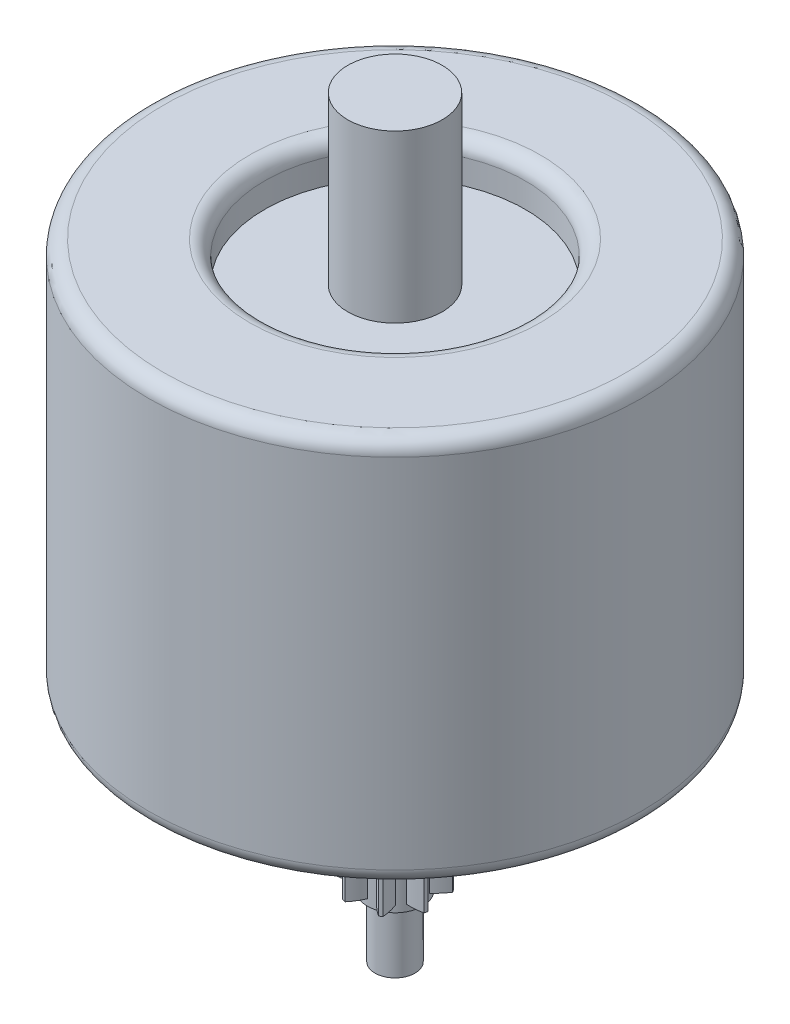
SolidWorks part; units mm, degrees
ref_plane "Front Plane" through (0, 0, 0) normal (0, 0, 1) x (1, 0, 0)
ref_plane "Top Plane" through (0, 0, 0) normal (0, 1, 0) x (1, 0, 0)
ref_plane "Right Plane" through (0, 0, 0) normal (1, 0, 0) x (0, 0, -1)
sketch "Sketch1" plane through (0, 0, 0) normal (0, 1, 0) x (1, 0, 0)
  circle A0 centre (0, 0) radius 16.45
  dimension "D1" = 32.9
extrude "Boss-Extrude1" add sketch "Sketch1" along normal blind 25.85
sketch "Sketch2" plane through (0, 25.85, 0) normal (0, 1, 0) x (1, 0, 0)
  circle A0 centre (0, 0) radius 8.7
  dimension "D1" = 17.4
extrude "Cut-Extrude1" cut sketch "Sketch2" against normal blind 2.65
sketch "Sketch3" plane through (0, 23.2, 0) normal (0, 1, 0) x (1, 0, 0)
  circle A0 centre (0, 0) radius 3.15
  dimension "D1" = 6.3
extrude "Boss-Extrude2" add sketch "Sketch3" along normal blind 11.1
sketch "Sketch4" plane through (0, 0, 0) normal (0, -1, 0) x (1, 0, 0)
  circle A0 centre (0, 0) radius 8.7
  dimension "D1" = 17.4
extrude "Cut-Extrude2" cut sketch "Sketch4" against normal blind 3.2
sketch "Sketch5" plane through (0, 3.2, 0) normal (0, -1, 0) x (1, 0, 0)
  circle A0 centre (0, 0) radius 1.335
  dimension "D1" = 2.67
extrude "Boss-Extrude3" add sketch "Sketch5" along normal blind 19.12
sketch "Sketch6" plane through (0, 3.2, 0) normal (0, -1, 0) x (1, 0, 0)
  circle A0 centre (0, 0) radius 2.825
  dimension "D1" = 5.65
extrude "Boss-Extrude4" add sketch "Sketch6" along normal blind 14.56
fillet "Fillet1" radius 1 4 edges at (0, 0, -8.7) (0, 0, 16.45) (0, 25.85, 8.7) (0, 25.85, 16.45)
sketch "Sketch15" plane through (0, -11.36, 0) normal (0, -1, 0) x (1, 0, 0)
  line L0 (0, 0) -> (0.4311, 2.7919) construction
  line L1 (0, 0) -> (0.2037, 1.3194)
  arc A0 (1.3721, 2.4694) -> (-0.5634, 2.7682) centre (0, 0) ccw
  circle A1 centre (0, 0) radius 2.825 construction
  circle A2 centre (0, 0) radius 1.335 construction
  arc A3 (-0.5634, 2.7682) -> (0.2037, 1.3194) centre (-3.6399, 0.2118) cw
  arc A4 (0.2037, 1.3194) -> (1.3721, 2.4694) centre (3.5343, -0.8959) cw
  dimension "D1" = 2
  dimension "D2" = 4
  dimension "D3" = 4
extrude "Cut-Extrude9" cut sketch "Sketch15" against normal blind 14.56 contours A4 A0 A3
pattern_circular "CirPattern3" count 8 over 360 about axis through (0, 0, 0) along (0, 1, 0) of "Cut-Extrude9"
sketch "Sketch16" plane through (0, 3.2, 0) normal (0, -1, 0) x (1, 0, 0)
  circle A0 centre (0, 0) radius 1.835
  dimension "D1" = 3.67
extrude "Boss-Extrude6" add sketch "Sketch16" along normal blind 15
